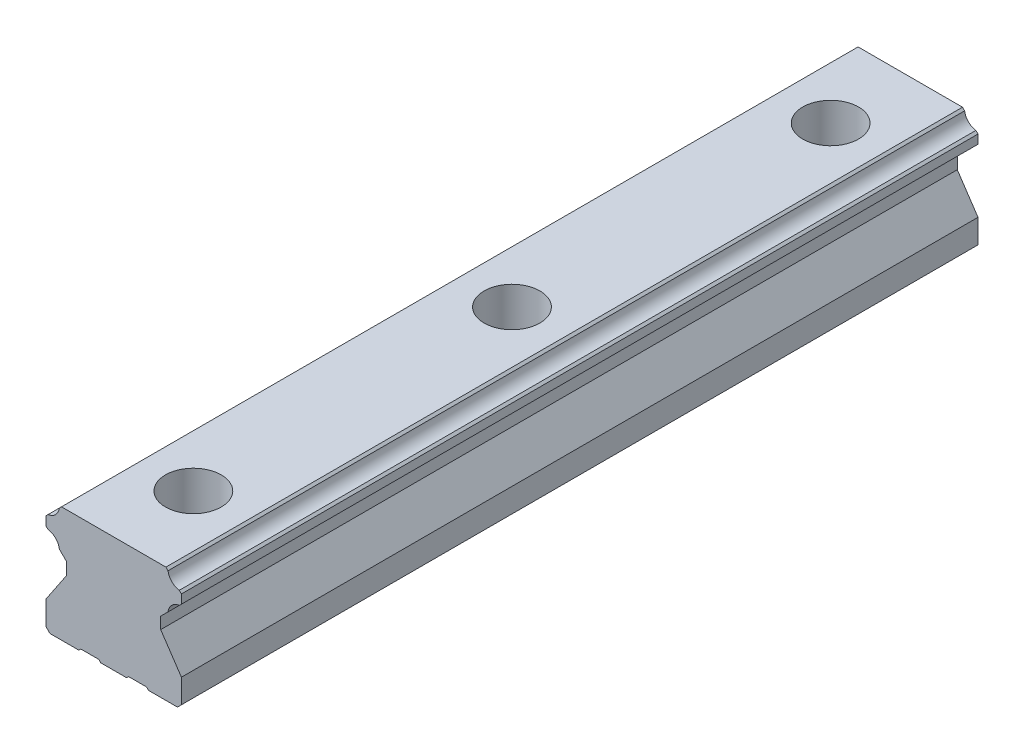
SolidWorks part; units mm, degrees
ref_plane "Front Plane" through (0, 0, 0) normal (0, 0, 1) x (1, 0, 0)
ref_plane "Top Plane" through (0, 0, 0) normal (0, 1, 0) x (1, 0, 0)
ref_plane "Right Plane" through (0, 0, 0) normal (1, 0, 0) x (0, 0, -1)
sketch "Sketch1" plane through (0, 0, 0) normal (0, 0, 1) x (1, 0, 0)
  line L0 (16.4706, 25.6394) -> (17, 25.11)
  line L1 (13.11, 29) -> (13.6394, 28.4706)
  line L2 (-13.11, 29) -> (13.11, 29)
  line L3 (-13.6394, 28.4706) -> (-13.11, 29)
  line L4 (-17, 25.11) -> (-16.4706, 25.6394)
  line L5 (-17, 22.88) -> (-17, 25.11)
  line L6 (-16.4821, 22.3621) -> (-17, 22.88)
  line L7 (-11.8, 17.68) -> (-13.6379, 19.5179)
  line L8 (-11.8, 14.75) -> (-11.8, 17.68)
  line L9 (-17, 7) -> (-11.8, 14.75)
  line L10 (-17, 1) -> (-17, 7)
  line L11 (-16, 0) -> (-17, 1)
  line L12 (-8.75, 0) -> (-16, 0)
  line L13 (-8.25, 0.5) -> (-8.75, 0)
  line L14 (-3.75, 0.5) -> (-8.25, 0.5)
  line L15 (-3.25, 0) -> (-3.75, 0.5)
  line L16 (3.25, 0) -> (-3.25, 0)
  line L17 (3.75, 0.5) -> (3.25, 0)
  line L18 (8.25, 0.5) -> (3.75, 0.5)
  line L19 (8.75, 0) -> (8.25, 0.5)
  line L20 (16, 0) -> (8.75, 0)
  line L21 (17, 1) -> (16, 0)
  line L22 (17, 7) -> (17, 1)
  line L23 (11.8, 14.75) -> (17, 7)
  line L24 (11.8, 17.68) -> (11.8, 14.75)
  line L25 (13.6379, 19.5179) -> (11.8, 17.68)
  line L26 (17, 22.88) -> (16.4821, 22.3621)
  line L27 (17, 25.11) -> (17, 22.88)
  arc A0 (13.6394, 28.4706) -> (16.4706, 25.6394) centre (16.91, 28.91) ccw
  arc A1 (-16.4706, 25.6394) -> (-13.6394, 28.4706) centre (-16.91, 28.91) ccw
  arc A2 (-13.6379, 19.5179) -> (-16.4821, 22.3621) centre (-16.91, 19.09) ccw
  arc A3 (16.4821, 22.3621) -> (13.6379, 19.5179) centre (16.91, 19.09) ccw
extrude "Boss-Extrude1" add sketch "Sketch1" against normal blind 200 contours L2 L1 A0 L0 L27 L26 A3 L25 L24 L23 L22 L21 L20 L19 L18 L17 L16 L15 L14 L13 L12 L11 L10 L9 L8 L7 A2 L6 L5 L4 A1 L3
hole_wizard "CBORE for M8 Hex Socket Head Cap Screw1" positions "Sketch2" profile "Sketch3" counterbore size "M8" standard "ISO"
sketch "Sketch2" plane through (0, 29, 0) normal (0, 1, 0) x (1, 0, 0)
  line L0 (-13.11, 0) -> (13.11, 0) construction
  point P0 (0, 20)
  dimension "D1" = 20
sketch "Sketch3" plane through (0, 29, -20) normal (1, 0, 0) x (0, 0, 1)
  line L0 (0, 0) -> (0, 29)
  line L1 (0, 29) -> (4.5, 29)
  line L3 (4.5, 29) -> (4.5, 12)
  line L4 (4.5, 12) -> (7, 12)
  line L5 (7, 12) -> (7, 0)
  line L7 (7, 0) -> (0, 0)
  line L11 (0, -6.35) -> (0, 107.95) construction
  dimension "Thru Hole Dia." = 9
  dimension "Thru Hole Depth" = 29
  dimension "C'Bore Dia." = 14
  dimension "C'Bore Depth" = 12
pattern_linear "LPattern1" count 3 spacing 80 along (0, 0, -1) of "CBORE for M8 Hex Socket Head Cap Screw1"
